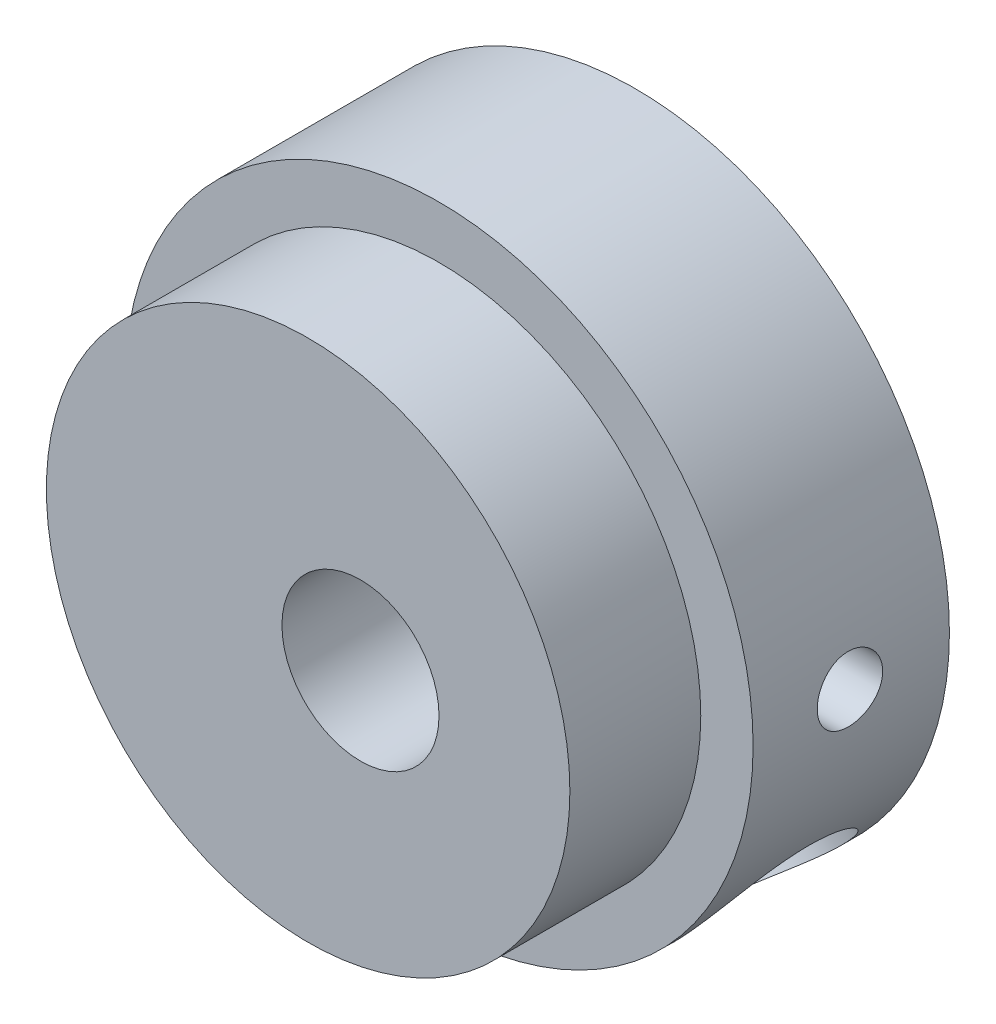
SolidWorks part; units mm, degrees
ref_plane "Front Plane" through (0, 0, 0) normal (0, 0, 1) x (1, 0, 0)
ref_plane "Top Plane" through (0, 0, 0) normal (0, 1, 0) x (1, 0, 0)
ref_plane "Right Plane" through (0, 0, 0) normal (1, 0, 0) x (0, 0, -1)
sketch "Sketch1" plane through (0, 0, 0) normal (0, 0, 1) x (1, 0, 0)
  line L0 (-471.5362, 0) -> (23105.2727, 0) construction
  line L1 (0, -471.5362) -> (0, 23105.2727) construction
  circle A0 centre (0, 0) radius 30.48
  dimension "D1" = 60.96
extrude "Boss-Extrude1" add sketch "Sketch1" along normal blind 19.05
sketch "Sketch2" plane through (0, 0, 19.05) normal (0, 0, 1) x (1, 0, 0)
  circle A0 centre (0, 0) radius 25.4
  dimension "D1" = 50.8
extrude "Boss-Extrude2" add sketch "Sketch2" along normal blind 12.7
sketch "Sketch3" plane through (0, 0, 0) normal (0, 0, -1) x (-1, 0, 0)
  circle A0 centre (-5.08, 0) radius 7.62
  dimension "D2" = 15.24
  dimension "D1" = 5.08
extrude "Cut-Extrude1" cut sketch "Sketch3" against normal blind 47.752
sketch "Sketch4" plane through (0, 0, 0) normal (1, 0, 0) x (0, 0, -1)
  circle A0 centre (-9.652, 0) radius 3.175
  dimension "D1" = 6.35
  dimension "D2" = 9.652
extrude "Cut-Extrude2" cut sketch "Sketch4" along normal blind 47.752
ref_plane "Plane1" through (0, 0, 9.652) normal (0, 0, -1) x (-1, 0, 0)
sketch "Sketch5" plane through (0, 0, 9.652) normal (0, 0, -1) x (-1, 0, 0)
  line L0 (0, 0) -> (-30.48, 0) construction
  line L1 (0, 0) -> (-21.5526, -21.5526) construction
  circle A0 centre (0, 0) radius 30.48 construction
  dimension "D1" = 45
ref_plane "Plane2" through (21.5526, -21.5526, 9.652) normal (0.7071, -0.7071, 0) x (-0.7071, -0.7071, 0)
hole_wizard "CBORE for 5/16 Pan Head Machine Screw2" positions "Sketch7" profile "Sketch8" counterbore size "5/16" standard "ANSI Inch"
sketch "Sketch7" plane through (21.5526, -21.5526, 9.652) normal (0.7071, -0.7071, 0) x (-0.7071, -0.7071, 0)
  point P0 (0, 0)
sketch "Sketch8" plane through (21.5526, -21.5526, 9.652) normal (0, 0, 1) x (0.7071, 0.7071, 0)
  line L0 (0, 0) -> (0, 18.5355)
  line L1 (0, 18.5355) -> (4.2164, 16.002)
  line L2 (4.2164, 16.002) -> (4.2164, 5.5372)
  line L3 (4.2164, 5.5372) -> (8.1356, 5.5372)
  line L4 (8.1356, 5.5372) -> (8.1356, 0)
  line L5 (8.1356, 0) -> (0, 0)
  line L10 (0, 18.5355) -> (-4.2164, 16.002) construction
  line L11 (0, -6.35) -> (0, 107.95) construction
  dimension "Hole Dia." = 8.4328
  dimension "Hole Depth" = 16.002
  dimension "C'Bore Dia." = 16.2712
  dimension "C'Bore Depth" = 5.5372
  dimension "Drill Angle" = 118
